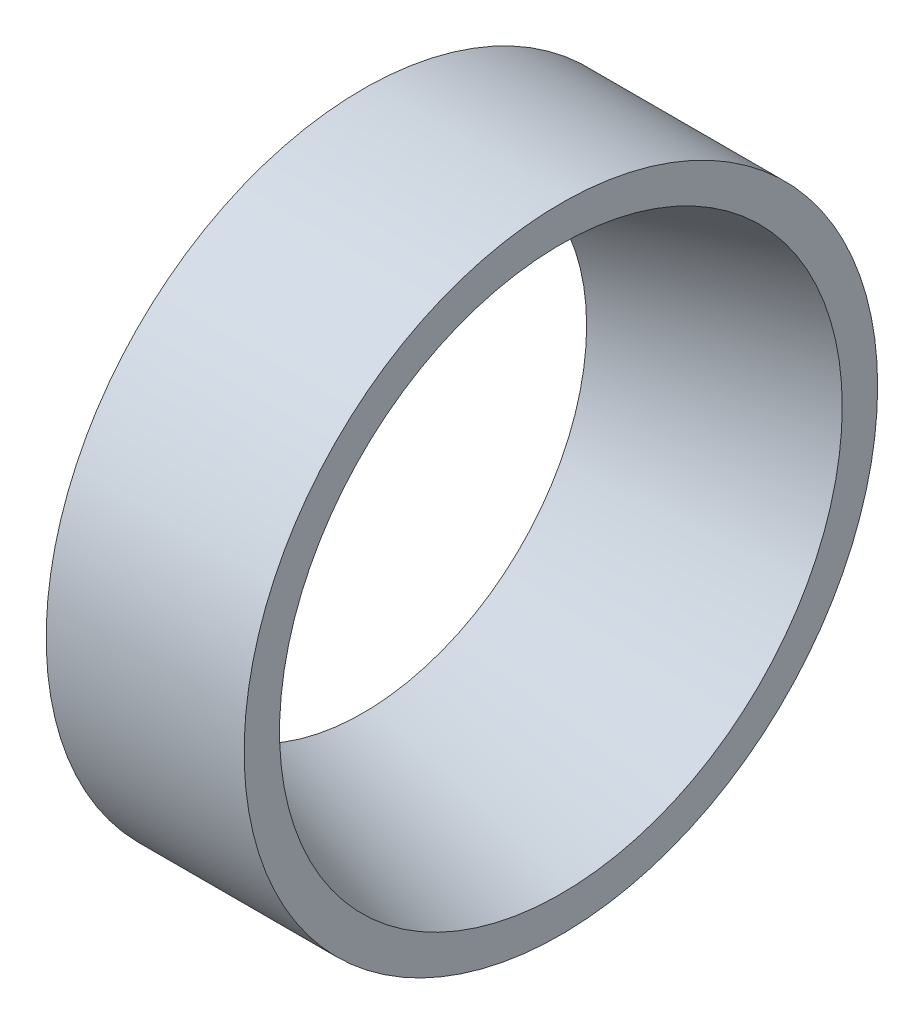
SolidWorks part; units mm, degrees
ref_plane "Plan1" through (0, 0, 0) normal (0, 0, 1) x (1, 0, 0)
ref_plane "Plan2" through (0, 0, 0) normal (0, 1, 0) x (1, 0, 0)
ref_plane "Plan3" through (0, 0, 0) normal (1, 0, 0) x (0, 0, -1)
sketch "Esquisse1" plane through (0, 0, 0) normal (0, 0, 1) x (1, 0, 0)
  line L0 (0, 14.212) -> (0, 16)
  line L1 (0, 16) -> (-10, 16)
  line L2 (-10, 16) -> (-10, 11.3)
  line L3 (-10, 11.3) -> (0, 14.212)
  line L4 (40, 0) -> (-40, 0) construction
  dimension "D1" = 1.788
  dimension "D2" = 10
  dimension "D3" = 4.7
  dimension "D4" = 16
revolve "Base-Révolution" add sketch "Esquisse1" angle 360 about L4
